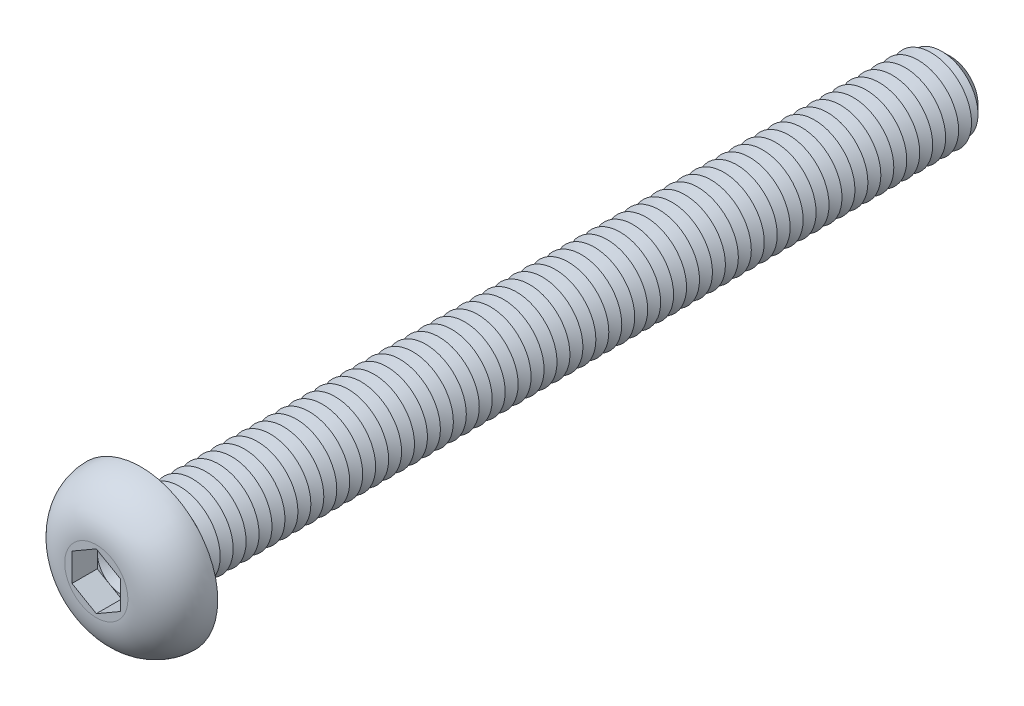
SolidWorks part; units mm, degrees
ref_plane "Front Plane" through (0, 0, 0) normal (0, 0, 1) x (1, 0, 0)
ref_plane "Top Plane" through (0, 0, 0) normal (0, 1, 0) x (1, 0, 0)
ref_plane "Right Plane" through (0, 0, 0) normal (1, 0, 0) x (0, 0, -1)
sketch "Sketch1" plane through (0, 0, 0) normal (1, 0, 0) x (0, 0, -1)
  line L0 (-47.9342, 0) -> (60.3146, 0) construction
sketch "Sketch2" plane through (0, 0, 0) normal (1, 0, 0) x (0, 0, -1)
  line L0 (0, 0) -> (-2.75, 0)
  line L1 (-47.9342, 0) -> (60.3146, 0) construction
  line L2 (-2.75, 0) -> (-2.75, 1.9504)
  line L3 (0, 4.75) -> (0, 0)
  arc A0 (-2.75, 1.9504) -> (0, 4.75) centre (0.05, 1.9504) cw
  dimension "D1" = 2.8
  dimension "D2" = 2.75
  dimension "D3" = 4.75
revolve "Revolve1" add sketch "Sketch2" angle 360 about L0
sketch "Sketch3" plane through (0, 0, 2.75) normal (0, 0, 1) x (1, 0, 0)
  line L1 (0, 1.7321) -> (-1.5, 0.866)
  line L2 (-1.5, 0.866) -> (-1.5, -0.866)
  line L3 (-1.5, -0.866) -> (0, -1.7321)
  line L4 (0, -1.7321) -> (1.5, -0.866)
  line L5 (1.5, -0.866) -> (1.5, 0.866)
  line L6 (1.5, 0.866) -> (0, 1.7321)
  circle A0 centre (0, 0) radius 1.5 construction
  dimension "D1" = 3
extrude "Cut-Extrude1" cut sketch "Sketch3" against normal blind 1.56
sketch "Sketch4" plane through (0, 0, 0) normal (0, 0, -1) x (-1, 0, 0)
  circle A0 centre (0, 0) radius 2.5
  dimension "D1" = 5
extrude "Boss-Extrude1" add sketch "Sketch4" along normal blind 50
chamfer "Chamfer1" distance 0.8 angle 45 1 edges at (-2.5, 0, -50)
sketch "Sketch5" plane through (0, 0, 0) normal (1, 0, 0) x (0, 0, -1)
  line L0 (0.8, 2.5) -> (1.6, 2.5)
  line L1 (49.2, 2.5) -> (0, 2.5) construction
  line L2 (1.6, 2.5) -> (1.2, 1.8072)
  line L3 (1.2, 1.8072) -> (0.8, 2.5)
  line L4 (0, -4.75) -> (0, 4.75) construction
  line L5 (49.2, 2.5) -> (0, 2.5) construction
  dimension "D1" = 0.8
  dimension "D2" = 0.8
revolve "Cut-Revolve1" cut sketch "Sketch5" angle 360 about L0
pattern_linear "LPattern1" count 61 spacing 0.8 along (0, 0, -1) of "Cut-Revolve1"
fillet "Fillet2" radius 0.4 1 edges at (2.5, 0, 0)
sketch "Sketch6" plane through (0, 0, 1.19) normal (0, 0, 1) x (1, 0, 0)
  line L0 (0, -1.7321) -> (1.5, -0.866) construction
  circle A0 centre (0, 0) radius 1.5
extrude "Cut-Extrude2" cut sketch "Sketch6" against normal through all draft 60
